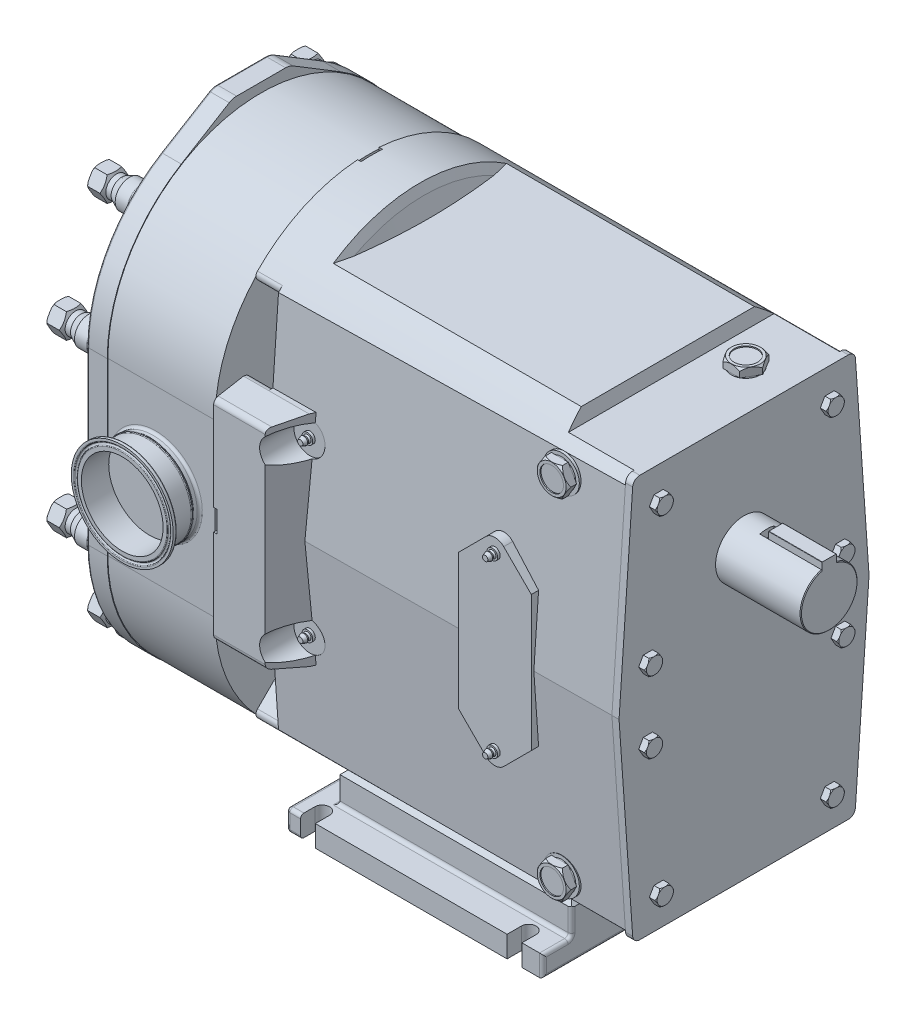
SolidWorks part; units mm, degrees
ref_plane "Front Plane" through (0, 0, 0) normal (0, 0, 1) x (1, 0, 0)
ref_plane "Top Plane" through (0, 0, 0) normal (0, 1, 0) x (1, 0, 0)
ref_plane "Right Plane" through (0, 0, 0) normal (1, 0, 0) x (0, 0, -1)
other "Join1"
other "grease fitting<4>@180_U2_Upper Shaft"
other "grease fitting<2>@180_U2_Upper Shaft"
other "cleanout plug<2>@180_U2_Upper Shaft"
other "oil plug<6>@180_U2_Upper Shaft"
other "oil plug<4>@180_U2_Upper Shaft"
other "108372<8>@180_U2_Upper Shaft"
other "108372<7>@180_U2_Upper Shaft"
other "108372<6>@180_U2_Upper Shaft"
other "108372<4>@180_U2_Upper Shaft"
other "108372<3>@180_U2_Upper Shaft"
other "108372<2>@180_U2_Upper Shaft"
other "Key_220<1>@180_U2_Upper Shaft"
other "Shaft_220<1>@180_U2_Upper Shaft"
other "grease fitting<3>@180_U2_Upper Shaft"
other "grease fitting<1>@180_U2_Upper Shaft"
other "cleanout plug<1>@180_U2_Upper Shaft"
other "oil plug<5>@180_U2_Upper Shaft"
other "oil plug<3>@180_U2_Upper Shaft"
other "oil plug<2>@180_U2_Upper Shaft"
other "oil plug<1>@180_U2_Upper Shaft"
other "plate_220<1>@180_U2_Upper Shaft"
other "108372<5>@180_U2_Upper Shaft"
other "108372<1>@180_U2_Upper Shaft"
other "101851<1>@180_U2_Upper Shaft"
other "107234<1>@180_U2_Upper Shaft"
other "230110000<1>@180_U2_Upper Shaft"
other "230005000<1>@180_U2_Upper Shaft"
other "130360008<2>@180_U2_Upper Shaft"
other "130360008<1>@180_U2_Upper Shaft"
